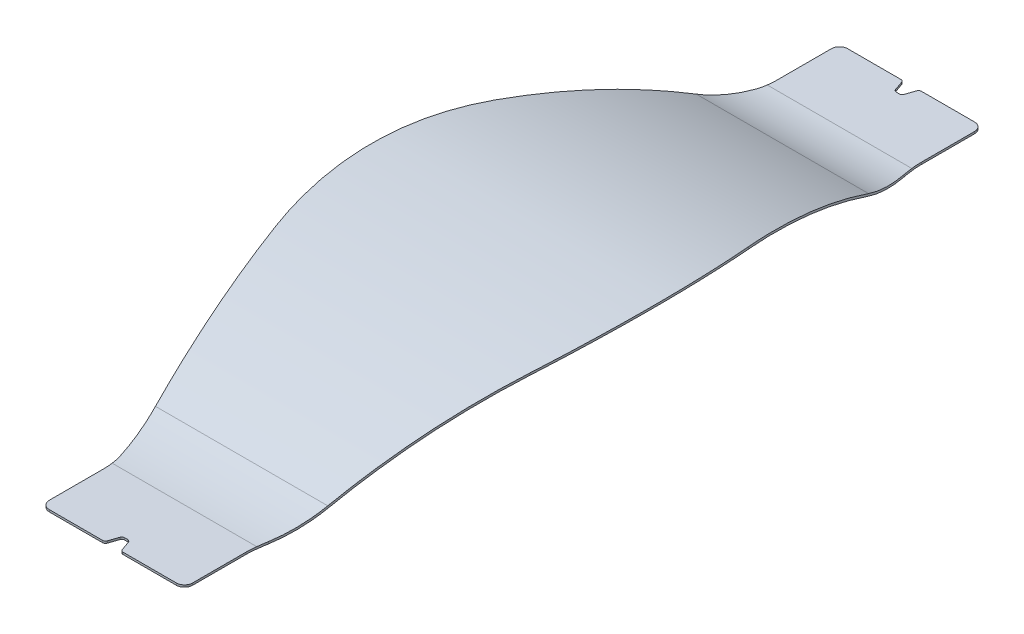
SolidWorks part; units mm, degrees
ref_plane "Front Plane" through (0, 0, 0) normal (0, 0, 1) x (1, 0, 0)
ref_plane "Top Plane" through (0, 0, 0) normal (0, 1, 0) x (1, 0, 0)
ref_plane "Right Plane" through (0, 0, 0) normal (1, 0, 0) x (0, 0, -1)
sketch "Sketch1" plane through (0, 0, 0) normal (1, 0, 0) x (0, 0, -1)
  line L0 (-390, 0) -> (390, 0) construction
  point P4 (0, 0)
  dimension "D1" = 780
sketch "Sketch2" plane through (0, 0, 0) normal (0, 1, 0) x (1, 0, 0)
  line L0 (0, 390) -> (70, 390)
  line L1 (0, -390) -> (0, 390) construction
  line L2 (70, 390) -> (70, 320)
  line L3 (0, 0) -> (137.5, 0)
  dimension "D1" = 70
  dimension "D2" = 70
  dimension "D3" = 137.5
ref_plane "Plane1" through (0, 77, 0) normal (0, 1, 0) x (1, 0, 0)
sketch "Sketch3" plane through (0, 77, 0) normal (0, 1, 0) x (1, 0, 0)
  line L0 (0, 0) -> (137.5, 0)
sketch "Sketch4" plane through (0, 0, 0) normal (1, 0, 0) x (0, 0, -1)
  line L0 (151.25, 77) -> (-151.25, 77) construction
  line L1 (-390, 0) -> (390, 0) construction
  line L2 (0, 77) -> (-72.7753, 77) construction
  line L3 (0, 77) -> (0, 0) construction
  line L4 (320, 0) -> (390, 0)
  line L5 (263.2839, 13.6473) -> (290, 0) construction
  line L6 (290, 0) -> (320, 0) construction
  arc A0 (0, 77) -> (263.2839, 13.6473) centre (0, -501.7597) cw
  arc A1 (263.2839, 13.6473) -> (320, 0) centre (320, 124.6753) ccw
  dimension "D1" = 30
extrude "Extrude-Thin1" add sketch "Sketch4" along normal mid plane 300 thin
mirror "Mirror1" about plane through (150, 77, 0) normal (0, 0, 1) of "Extrude-Thin1"
sketch "Sketch5" plane through (0, 0, 0) normal (0, 1, 0) x (1, 0, 0)
  line L0 (0, 390) -> (70, 390)
  line L1 (70, 390) -> (70, 330)
  line L2 (137.5, 0) -> (137.5, -147.2159) construction
  line L3 (0, 390) -> (0, 527.6394)
  line L4 (0, 527.6394) -> (272.3894, 527.6394)
  line L5 (272.3894, 527.6394) -> (272.3894, 0)
  line L6 (272.3894, 0) -> (137.5, 0)
  line L7 (72.4615, 310.3077) -> (124.1538, 106.7692)
  arc A0 (137.5, 0) -> (124.1538, 106.7692) centre (-296.25, 0) ccw
  arc A2 (70, 330) -> (72.4615, 310.3077) centre (150, 330) ccw
  point P17 (70, 320)
  point P18 (97.2381, 91.6927)
  dimension "D2" = 80
  dimension "D1" = 220
extrude "Cut-Extrude3" cut sketch "Sketch5" against normal through all and the other way through all contours L1 A2 L7 A0 L6 L5 L4 L3 L0
mirror "Mirror4" about plane through (0, 0, 0) normal (0, 0, 1) of "Cut-Extrude3"
mirror "Mirror5" about plane through (0, 0, 0) normal (1, 0, 0) of "Mirror4", "Cut-Extrude3"
sketch "Sketch9" plane through (0, 2, 0) normal (0, 1, 0) x (1, 0, 0)
  line L0 (0, 390) -> (0, 377)
  line L1 (70, 390) -> (-70, 390) construction
  line L2 (0, 377) -> (3.5, 377)
  line L3 (3.5, 377) -> (8, 390)
  line L4 (8, 390) -> (0, 390)
  dimension "D1" = 8
  dimension "D2" = 13
  dimension "D3" = 3.5
extrude "Cut-Extrude4" cut sketch "Sketch9" against normal blind 100
mirror "Mirror7" about plane through (0, 0, 0) normal (1, 0, 0) of "Cut-Extrude4"
mirror "Mirror11" about plane through (0, 0, 0) normal (0, 0, 1) of "Mirror7", "Cut-Extrude4"
fillet "Fillet4" radius 3 8 edges at (-8, 1, 390) (8, 1, 390) (3.5, 1, 377) (-3.5, 1, 377) (-8, 1, -390) (-3.5, 1, -377) (3.5, 1, -377) (8, 1, -390)
fillet "Fillet5" radius 8 4 edges at (70, 1, -390) (-70, 1, -390) (-70, 1, 390) (70, 1, 390)
scale "Scale2" scale about centroid uniform scaling yes scale factor 1.008
